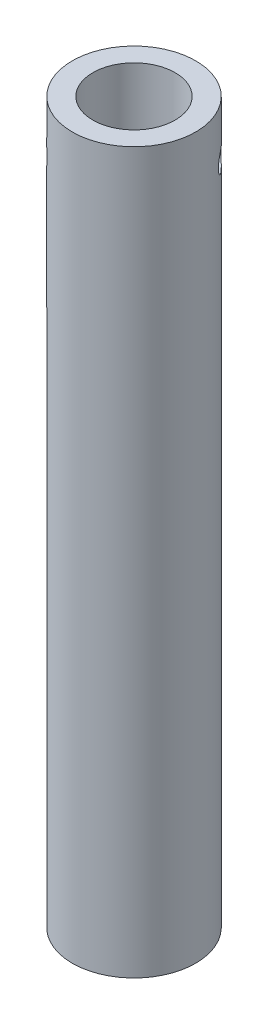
SolidWorks part; units mm, degrees
ref_plane "Front Plane" through (0, 0, 0) normal (0, 0, 1) x (1, 0, 0)
ref_plane "Top Plane" through (0, 0, 0) normal (0, 1, 0) x (1, 0, 0)
ref_plane "Right Plane" through (0, 0, 0) normal (1, 0, 0) x (0, 0, -1)
sketch "Sketch1" plane through (0, 0, 0) normal (0, 1, 0) x (1, 0, 0)
  circle A0 centre (0, 0) radius 3
extrude "Boss-Extrude3" add sketch "Sketch1" along normal blind 35 contours A0
sketch "Sketch3" plane through (0, 35, 0) normal (0, 1, 0) x (1, 0, 0)
  circle A0 centre (0, 0) radius 2
extrude "Cut-Extrude2" cut sketch "Sketch3" against normal blind 57.55 contours A0
hole_wizard "Ø1.0 (1) Diameter Hole3" positions "3DSketch4" profile "Sketch6" hole size "Ø1.0" standard "ANSI Metric"
sketch3d "3DSketch4"
  point P0 (2.3029, 32.5, -1.9227)
  dimension "D1" = 2.5
sketch "Sketch6" plane through (2.3029, 32.5, -1.9227) normal (0, 1, 0) x (-0.6409, 0, -0.7676)
  line L0 (0, 0) -> (0, 10.2104)
  line L1 (0, 10.2104) -> (0.5, 9.91)
  line L2 (0.5, 9.91) -> (0.5, 0)
  line L5 (0.5, 0) -> (0, 0)
  line L10 (0, 10.2104) -> (-0.5, 9.91) construction
  line L11 (0, -6.35) -> (0, 107.95) construction
  dimension "Hole Dia." = 1
  dimension "Hole Depth" = 9.91
  dimension "Drill Angle" = 118
